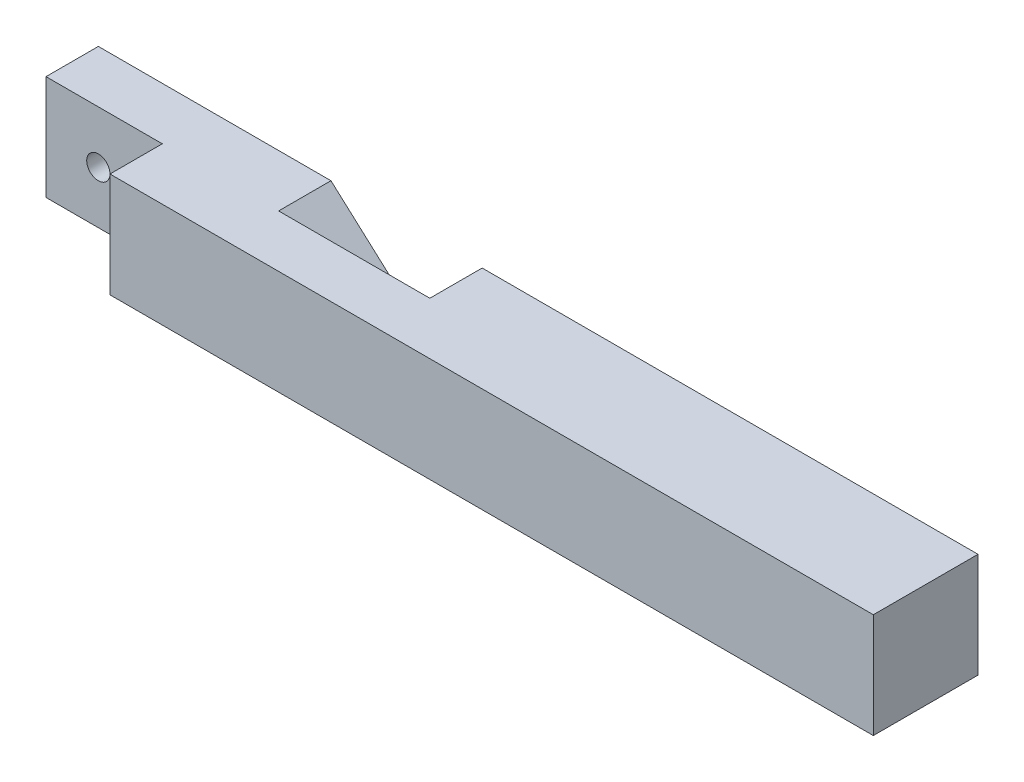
SolidWorks part; units mm, degrees
ref_plane "Plan de face" through (0, 0, 0) normal (0, 0, 1) x (1, 0, 0)
ref_plane "Plan de dessus" through (0, 0, 0) normal (0, 1, 0) x (1, 0, 0)
ref_plane "Plan de droite" through (0, 0, 0) normal (1, 0, 0) x (0, 0, -1)
sketch "Esquisse1" plane through (0, 0, 0) normal (0, 0, 1) x (1, 0, 0)
  line L1 (0, 0) -> (75.63, 0)
  line L2 (0, 0) -> (0, 9)
  line L3 (0, 9) -> (75.63, 9)
  line L4 (75.63, 0) -> (75.63, 9)
  dimension "D1" = 75.63
  dimension "D2" = 9
extrude "Extrusion1" add sketch "Esquisse1" along normal blind 9
sketch "Esquisse2" plane through (0, 0, 9) normal (0, 0, 1) x (1, 0, 0)
  line L0 (0, 0) -> (75.63, 0) construction
  line L1 (0, 9) -> (10, 9)
  line L2 (0, 9) -> (0, 0)
  line L3 (0, 0) -> (10, 0)
  line L4 (10, 9) -> (10, 0)
  dimension "D1" = 10
extrude "Enlèv. mat.-Extru.1" cut sketch "Esquisse2" against normal blind 4.5
sketch "Esquisse3" plane through (0, 0, 4.5) normal (0, 0, 1) x (1, 0, 0)
  line L0 (0, 9) -> (0, 0) construction
  line L1 (0, 0) -> (10, 0) construction
  circle A0 centre (4.5, 4.5) radius 1
  dimension "D3" = 2
  dimension "D1" = 4.5
  dimension "D2" = 4.5
extrude "Enlèv. mat.-Extru.2" cut sketch "Esquisse3" against normal blind 4.5
sketch "Esquisse4" plane through (0, 0, 0) normal (0, 0, -1) x (-1, 0, 0)
  line L0 (-20, 9) -> (-30, 0)
  line L1 (-75.63, 9) -> (0, 9) construction
  line L2 (0, 0) -> (-75.63, 0) construction
  line L3 (-30, 0) -> (-43, 0)
  line L4 (-43, 0) -> (-33, 9)
  line L5 (-33, 9) -> (-20, 9)
  dimension "D1" = 20
  dimension "D2" = 13
  dimension "D3" = 13
  dimension "D4" = 30
extrude "Enlèv. mat.-Extru.3" cut sketch "Esquisse4" against normal blind 4.5
